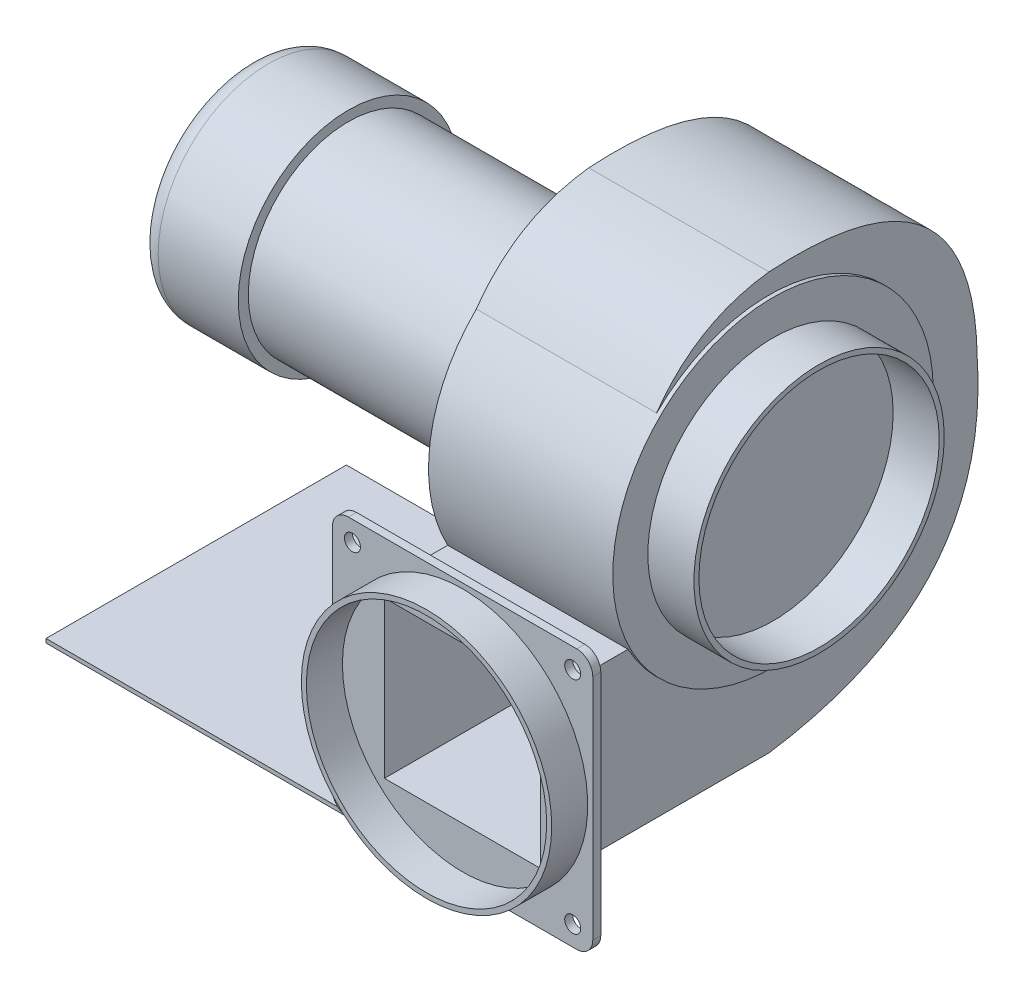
SolidWorks part; units mm, degrees
ref_plane "前视基准面" through (0, 0, 0) normal (0, 0, 1) x (1, 0, 0)
ref_plane "上视基准面" through (0, 0, 0) normal (0, 1, 0) x (1, 0, 0)
ref_plane "右视基准面" through (0, 0, 0) normal (1, 0, 0) x (0, 0, -1)
sketch "草图1" plane through (0, 0, 0) normal (1, 0, 0) x (0, 0, -1)
  line L2 (0, -118) -> (-104, -118)
  line L3 (-104, -118) -> (-104, -38)
  line L4 (-104, -38) -> (-70.3989, -38)
  arc A1 (-56.1338, 57) -> (-70.3989, -38) centre (0, 0) ccw
  spline S0 degree 2 poles (0, 90) (102.8353, 96.6692) (104, 0) knots 0 0 0 1 1 1
  spline S1 degree 2 poles (0, 90) (-36.2578, 85.6418) (-56.1338, 57) knots 0 0 0 1 1 1
  spline S2 degree 2 poles (104, 0) (110.5982, -101.6313) (0, -118) knots 0 0 0 1 1 1
extrude "凸台-拉伸1" add sketch "草图1" along normal blind 90
sketch "草图2" plane through (0, 0, 104) normal (0, 0, 1) x (1, 0, 0)
  line L4 (-12, -143) -> (102, -143)
  line L5 (-20, -135) -> (-20, -21)
  line L6 (-12, -13) -> (102, -13)
  line L7 (110, -135) -> (110, -21)
  line L8 (-20, -143) -> (110, -13) construction
  line L9 (-20, -13) -> (110, -143) construction
  arc A0 (102, -13) -> (110, -21) centre (102, -21) cw
  arc A1 (102, -143) -> (110, -135) centre (102, -135) ccw
  arc A2 (-12, -143) -> (-20, -135) centre (-12, -135) cw
  arc A3 (-20, -21) -> (-12, -13) centre (-12, -21) cw
  point P6 (45, -78)
  dimension "D1" = 8
extrude "凸台-拉伸2" add sketch "草图2" along normal blind 4
sketch "草图3" plane through (0, 0, 108) normal (0, 0, 1) x (1, 0, 0)
  circle A0 centre (45, -78) radius 62.5
  circle A1 centre (45, -78) radius 60
extrude "凸台-拉伸3" add sketch "草图3" along normal blind 18
sketch "草图4" plane through (0, 0, 108) normal (0, 0, 1) x (1, 0, 0)
  circle A0 centre (-10, -23) radius 4
  circle A1 centre (100, -23) radius 4
  circle A2 centre (100, -133) radius 4
  circle A3 centre (-10, -133) radius 4
  point P6 (45, -78)
extrude "切除-拉伸1" cut sketch "草图4" against normal blind 4
sketch "草图5" plane through (90, 0, 0) normal (1, 0, 0) x (0, 0, -1)
  circle A0 centre (0, 0) radius 80
extrude "凸台-拉伸4" add sketch "草图5" along normal blind 2
sketch "草图6" plane through (92, 0, 0) normal (1, 0, 0) x (0, 0, -1)
  circle A0 centre (0, 0) radius 62.5
  circle A1 centre (0, 0) radius 60
extrude "凸台-拉伸5" add sketch "草图6" along normal blind 23
sketch "草图7" plane through (0, 0, 108) normal (0, 0, 1) x (1, 0, 0)
  line L1 (6, -117) -> (84, -117)
  line L2 (6, -117) -> (6, -39)
  line L3 (6, -39) -> (84, -39)
  line L4 (84, -117) -> (84, -39)
  line L5 (6, -117) -> (84, -39) construction
  line L6 (6, -39) -> (84, -117) construction
  point P0 (45, -78)
extrude "切除-拉伸2" cut sketch "草图7" against normal blind 90
sketch "草图8" plane through (0, 0, 0) normal (-1, 0, 0) x (0, 0, 1)
  circle A0 centre (0, 0) radius 50
extrude "凸台-拉伸6" add sketch "草图8" along normal blind 120
sketch "草图9" plane through (-120, 0, 0) normal (-1, 0, 0) x (0, 0, 1)
  circle A0 centre (0, 0) radius 55
extrude "凸台-拉伸7" add sketch "草图9" along normal blind 50
fillet "圆角1" radius 10 1 edges at (-170, 0, 55)
sketch "草图10" plane through (0, 0, 0) normal (-1, 0, 0) x (0, 0, 1)
  line L0 (-46, -147) -> (-46, -67)
  line L1 (104, -147) -> (104, -67)
  line L2 (104, -38) -> (104, -118) construction
  line L3 (-46, -147) -> (104, -147)
  line L4 (104, -67) -> (-46, -67)
extrude "凸台-拉伸8" add sketch "草图10" along normal blind 2
sketch "草图11" plane through (-2, 0, 0) normal (-1, 0, 0) x (0, 0, 1)
  line L0 (-46, -147) -> (104, -147)
  line L1 (-46, -147) -> (-46, -145)
  line L2 (-46, -67) -> (-46, -147) construction
  line L3 (-46, -145) -> (104, -145)
  line L4 (104, -147) -> (104, -143) construction
  line L5 (104, -145) -> (104, -147)
extrude "凸台-拉伸9" add sketch "草图11" along normal blind 165
